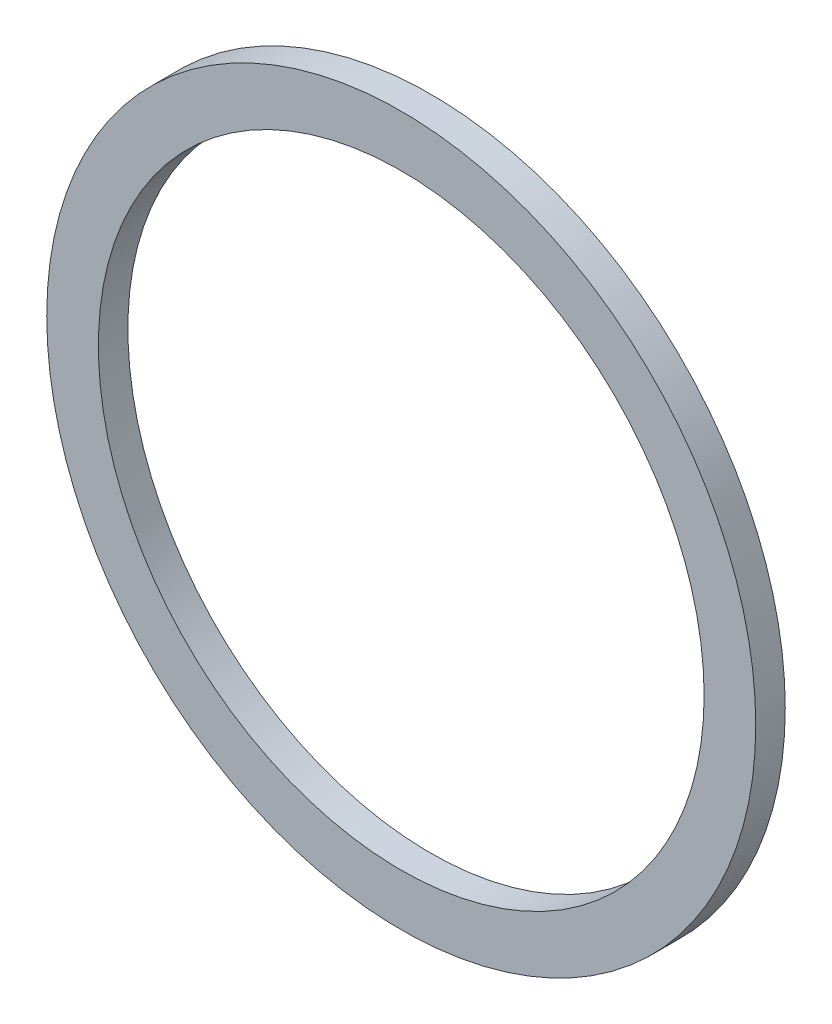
SolidWorks part; units mm, degrees
ref_plane "Front Plane" through (0, 0, 0) normal (0, 0, 1) x (1, 0, 0)
ref_plane "Top Plane" through (0, 0, 0) normal (0, 1, 0) x (1, 0, 0)
ref_plane "Right Plane" through (0, 0, 0) normal (1, 0, 0) x (0, 0, -1)
sketch "Sketch1" plane through (0, 0, 0) normal (0, 0, 1) x (1, 0, 0)
  circle A1 centre (0, 0) radius 19.225
  circle A2 centre (0, 0) radius 16.425
  dimension "D1" = 2.8
extrude "Boss-Extrude1" add sketch "Sketch1" along normal blind 1.6
